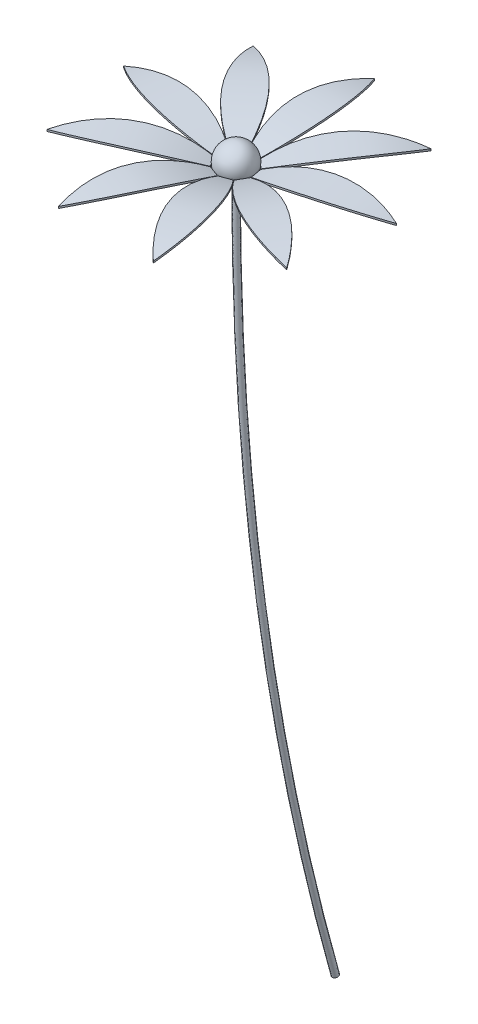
SolidWorks part; units mm, degrees
ref_plane "Front Plane" through (0, 0, 0) normal (0, 0, 1) x (1, 0, 0)
ref_plane "Top Plane" through (0, 0, 0) normal (0, 1, 0) x (1, 0, 0)
ref_plane "Right Plane" through (0, 0, 0) normal (1, 0, 0) x (0, 0, -1)
sketch "Sketch1" plane through (0, 0, 0) normal (0, 1, 0) x (1, 0, 0)
  circle A0 centre (0, 0) radius 5
  dimension "D1" = 10
extrude "Boss-Extrude1" add sketch "Sketch1" along normal blind 0.5
dome "Dome1" faces to dome 2 distance 6 parameters "D1"=6
sketch "Sketch2" plane through (0, 0, 0) normal (1, 0, 0) x (0, 0, -1)
  line L0 (5, 0.5) -> (5, 0)
  line L1 (5, 0) -> (5.1839, 0.035)
  arc A0 (5, 0.5) -> (40, 2.1587) centre (24.9277, -49.8973) cw
  arc A1 (5.1839, 0.035) -> (39.8609, 1.6784) centre (24.9277, -49.8973) cw
  arc A2 (40, 2.1587) -> (39.8609, 1.6784) centre (39.9305, 1.9186) cw
  dimension "D1" = 0.5
extrude "Boss-Extrude2" add sketch "Sketch2" along normal mid plane 10.5 separate body
sketch "Sketch3" plane through (0, 0, 0) normal (0, 1, 0) x (1, 0, 0)
  line L0 (5.25, 5) -> (-5.25, 5) construction
  line L1 (5.25, 40) -> (-5.25, 40) construction
  line L2 (0, 5) -> (0, 24.9765) construction
  line L3 (-1.7141, 5) -> (-9.7134, 0)
  line L4 (-9.7134, 0) -> (-17.9764, 37.1951)
  line L5 (-17.9764, 37.1951) -> (-10.9177, 45.7658)
  line L6 (-10.9177, 45.7658) -> (13.4493, 41.4805)
  line L7 (13.4493, 41.4805) -> (14.7151, 0)
  line L8 (14.7151, 0) -> (1.7141, 5)
  arc A0 (1.7141, 5) -> (0, 40) centre (-36.198, 20.6852) ccw
  arc A1 (-1.7141, 5) -> (0, 40) centre (36.198, 20.6852) cw
extrude "Cut-Extrude1" cut sketch "Sketch3" along normal blind 10.5
pattern_circular "CirPattern8" count 9 every 40 about axis through (0, 0, 0) along (0, 1, 0)
sketch "Sketch4" plane through (0, 0, 0) normal (0, 0, 1) x (1, 0, 0)
  line L0 (0.0912, 0.035) -> (0.0912, -5.5898)
  line L1 (0.0912, -5.5898) -> (-0.7868, -5.5898)
  line L2 (-5.3842, 0.035) -> (0.0912, 0.035)
  arc A0 (-5.3842, 0.035) -> (-0.7868, -5.5898) centre (-7.8678, -6.6861) cw
  spline S0 degree 3 poles (-5.3842, 0.035) (-8.2351, 1.0885) (-11.0575, 1.9466) (-14.5488, 2.739) (-15.2452, 2.8833) (-16.6341, 3.1424) (-17.3217, 3.2562) (-19.3495, 3.5481) (-20.661, 3.6781) (-23.2033, 3.8111) (-24.434, 3.8142) (-26.2168, 3.723) (-26.799, 3.6765) (-27.9246, 3.5542) (-28.4703, 3.4781) (-30.0572, 3.2079) (-31.0487, 2.9717) (-32.9028, 2.3978) (-33.7676, 2.0586) (-34.5575, 1.6784) knots 0 0 0 0 0.25 0.25 0.3125 0.3125 0.375 0.375 0.5 0.5 0.625 0.625 0.6875 0.6875 0.75 0.75 0.875 0.875 1 1 1 1 construction
revolve "Revolve2" add sketch "Sketch4" angle 360 about L0
sketch "Sketch5" plane through (0, -5.5898, 0) normal (0, -1, 0) x (1, 0, 0)
  circle A1 centre (0.0912, 0) radius 0.8781
  circle A2 centre (0.0912, 0) radius 0.8781
  dimension "D1" = 0
sketch "Sketch6" plane through (0, 0, 0) normal (1, 0, 0) x (0, 0, -1)
  line L0 (-0.8781, -5.5898) -> (0.8781, -5.5898) construction
  arc A0 (0, -5.5898) -> (28.5799, -216.2954) centre (775.4851, -7.6948) ccw
sweep "Sweep1" add profiles "Sketch5" path "Sketch6"
